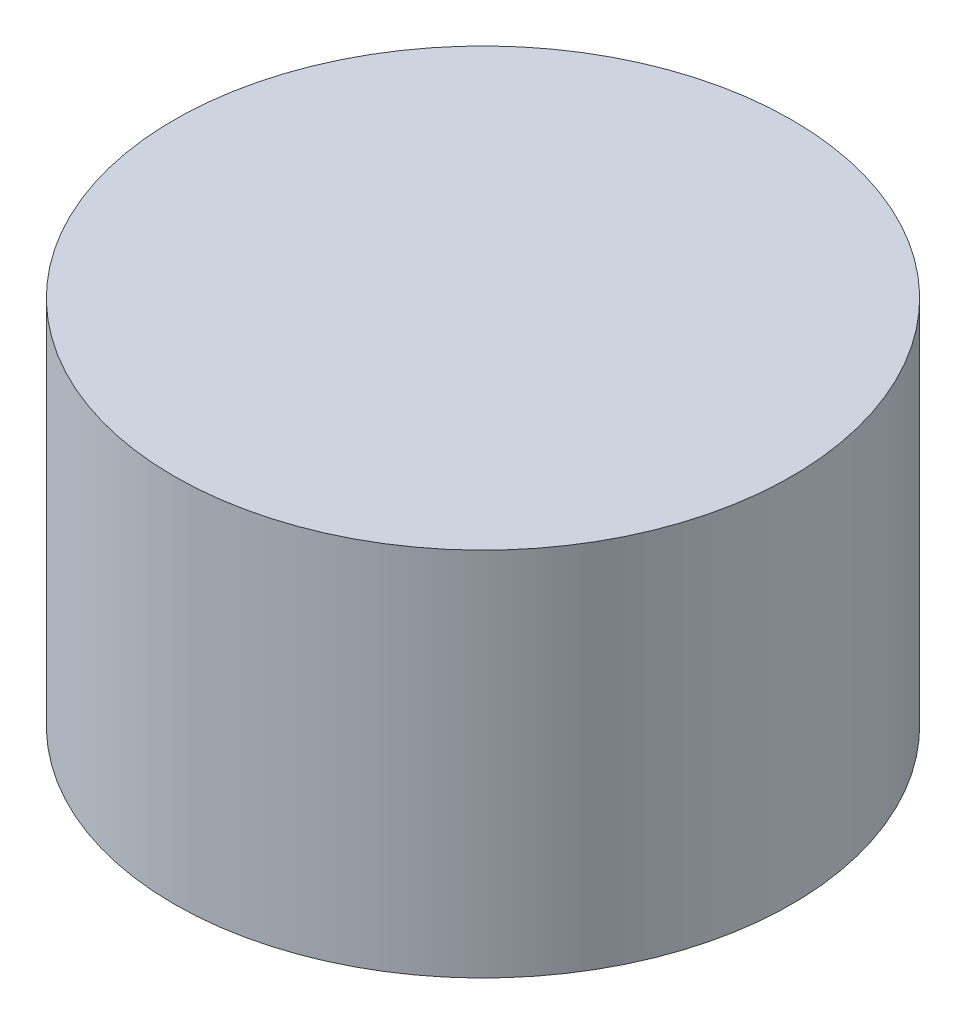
SolidWorks part; units mm, degrees
ref_plane "Front Plane" through (0, 0, 0) normal (0, 0, 1) x (1, 0, 0)
ref_plane "Top Plane" through (0, 0, 0) normal (0, 1, 0) x (1, 0, 0)
ref_plane "Right Plane" through (0, 0, 0) normal (1, 0, 0) x (0, 0, -1)
sketch "Sketch1" plane through (0, 0, 0) normal (0, 1, 0) x (1, 0, 0)
  circle A0 centre (0, 0) radius 25
  dimension "D1" = 50
extrude "Boss-Extrude1" add sketch "Sketch1" along normal blind 30
